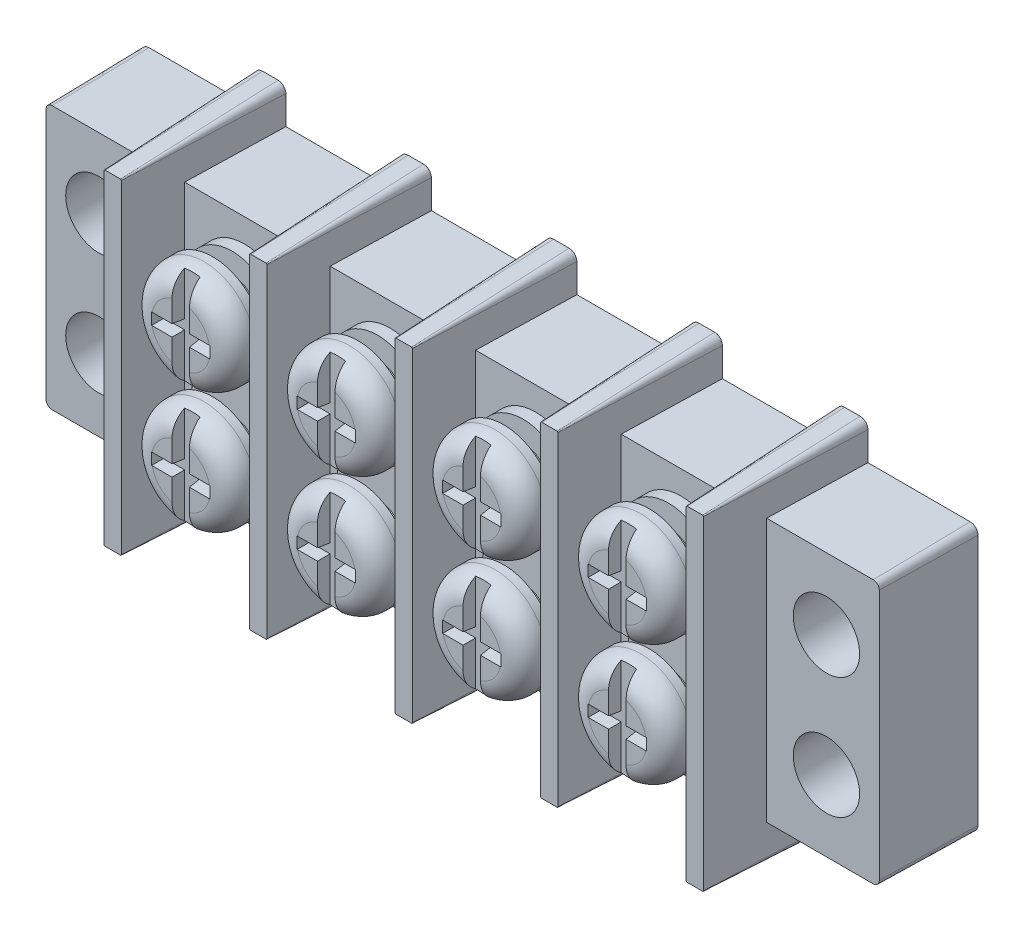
SolidWorks part; units mm, degrees
ref_plane "Plane1" through (0, 0, 0) normal (0, 0, 1) x (1, 0, 0)
ref_plane "Plane2" through (0, 0, 0) normal (0, 1, 0) x (1, 0, 0)
ref_plane "Plane3" through (0, 0, 0) normal (1, 0, 0) x (0, 0, -1)
sketch "BASE Sketch" plane through (0, 0, 0) normal (0, 0, 1) x (1, 0, 0)
  line L1 (-3.5719, 12.192) -> (-3.5719, -4.2545)
  line L4 (-3.5719, 3.9688) -> (51.1969, 3.9687) construction
  line L5 (23.8125, 3.9688) -> (23.8125, -4.7625) construction
  line L7 (-3.0639, 12.7) -> (50.6889, 12.7)
  line L8 (-3.0639, -4.7625) -> (50.6889, -4.7625)
  line L11 (51.1969, 12.192) -> (51.1969, -4.2545)
  circle A0 centre (0, 0) radius 1.7526 construction
  arc A1 (-3.0639, 12.7) -> (-3.5719, 12.192) centre (-3.0639, 12.192) ccw
  arc A2 (-3.0639, -4.7625) -> (-3.5719, -4.2545) centre (-3.0639, -4.2545) cw
  arc A3 (50.6889, -4.7625) -> (51.1969, -4.2545) centre (50.6889, -4.2545) ccw
  arc A4 (50.6889, 12.7) -> (51.1969, 12.192) centre (50.6889, 12.192) cw
  dimension "SCREW SIZE" = 3.5052
  dimension "GENERAL FILET" = 0.508
  dimension "M" = 47.625
  dimension "FIRST HOLE FROM END" = 3.5719
  dimension "LENGTH" = 54.7688
  dimension "BASE WIDTH" = 17.4625
  dimension "HOLE WIDTH" = 7.9375
extrude "BASE" add sketch "BASE Sketch" along normal blind 6.35 draft 1
sketch "RIB Sketch" plane through (0, 0, 0) normal (0, 0, -1) x (-1, 0, 0)
  line L0 (-4.3653, 15.0812) -> (-5.3813, 15.0812)
  line L1 (-3.8573, 14.5732) -> (-3.8573, -6.6358)
  line L2 (-5.3813, -7.1437) -> (-4.3653, -7.1437)
  line L3 (-5.8893, -6.6358) -> (-5.8893, 14.5732)
  line L4 (-4.8733, 15.0812) -> (-4.8733, -7.1438) construction
  line L5 (3.461, 3.9688) -> (-3.8573, 3.9687) construction
  line L6 (3.461, 12.192) -> (3.461, -4.2545) construction
  line L8 (3.461, 12.192) -> (3.461, -4.2545) construction
  arc A0 (-3.8573, 14.5732) -> (-4.3653, 15.0812) centre (-4.3653, 14.5732) ccw
  arc A1 (-5.8893, 14.5732) -> (-5.3813, 15.0812) centre (-5.3813, 14.5732) cw
  arc A2 (-5.8893, -6.6358) -> (-5.3813, -7.1437) centre (-5.3813, -6.6358) ccw
  arc A3 (-4.3653, -7.1437) -> (-3.8573, -6.6358) centre (-4.3653, -6.6358) ccw
  dimension "D1" = 2.032
  dimension "D2" = 8.3344
  dimension "RIB WIDTH" = 22.225
extrude "RIB" add sketch "RIB Sketch" against normal blind 10.3124 draft 2.5
sketch "HOLE Sketch" plane through (0, 0, 0) normal (0, 0, -1) x (-1, 0, 0)
  circle A0 centre (0, 0) radius 2.1717
  dimension "HOLE DIA" = 4.3434
extrude "HOLE" cut sketch "HOLE Sketch" against normal through all
pattern_linear "RIB Pattern" count 5 spacing 9.525 along (1, 0, 0) of "RIB"
pattern_linear "HOLE Pattern" count 6 spacing 9.525 along (1, 0, 0) count 2 spacing 7.9375 along (0, 1, 0) of "HOLE"
sketch "TERMINAL Sketch" plane through (0, 0, 6.35) normal (0, 0, 1) x (1, 0, 0)
  line L0 (-3.5719, 3.9688) -> (51.1969, 3.9687) construction
  line L4 (7.1559, 3.9688) -> (11.8941, 3.9688) construction
  line L5 (9.525, 11.0443) -> (9.525, -3.1068) construction
  circle A0 centre (9.525, 7.9375) radius 1.7475
  circle A1 centre (9.525, 0) radius 1.7475
  arc A2 (12.4243, 6.8211) -> (6.6257, 6.8211) centre (9.525, 7.9375) ccw
  arc A3 (12.4243, 1.1164) -> (6.6257, 1.1164) centre (9.525, 0) cw
  arc A4 (6.6257, 6.8211) -> (6.6257, 1.1164) centre (-0.7816, 3.9688) cw
  arc A5 (12.4243, 6.8211) -> (12.4243, 1.1164) centre (19.8316, 3.9688) ccw
  dimension "D5" = 3.495
  dimension "D2" = 3.1068
  dimension "D6" = 7.9375
extrude "TERMINAL" add sketch "TERMINAL Sketch" along normal blind 0.8128
pattern_linear "TERMINAL Pattern" count 4 spacing 9.525 along (1, 0, 0) of "TERMINAL"
sketch "SCREW Sketch" plane through (0, 0, 0) normal (0, 1, 0) x (1, 0, 0)
  line L0 (11.2776, -8.4328) -> (11.2776, -6.35)
  line L1 (11.2776, -8.4328) -> (12.954, -8.4328)
  line L2 (5.6121, -6.35) -> (13.6596, -6.35) construction
  line L3 (11.2776, -6.35) -> (9.525, -6.35)
  line L4 (9.525, -6.35) -> (9.525, -10.5156)
  line L5 (12.954, -10.5156) -> (9.525, -10.5156)
  line L6 (9.525, -6.35) -> (9.525, -6.8704) construction
  line L8 (12.954, -10.5156) -> (12.954, -8.4328)
  line L9 (7.7775, -7.1628) -> (11.2725, -7.1628) construction
  dimension "D1" = 1.27
  dimension "SCREW HEAD THICK" = 2.0828
  dimension "D3" = 9.525
  dimension "SCREW HEAD DIA" = 6.858
  dimension "SCREW DIA" = 3.5052
revolve "SCREW" add sketch "SCREW Sketch" angle 360 about L6
fillet "SCREW HEAD FILET" radius 1.5204 1 edges at (6.096, 0, 10.5156)
sketch "SCREW SLOT Sketch" plane through (0, 0, 10.5156) normal (0, 0, 1) x (1, 0, 0)
  line L0 (8.9535, 3.429) -> (10.0965, 3.429)
  line L1 (8.9535, 3.429) -> (8.9535, 0.381)
  line L2 (10.0965, -3.429) -> (8.9535, -3.429)
  line L3 (10.0965, -3.429) -> (10.0965, -0.381)
  line L4 (7.6164, 0.381) -> (8.9535, 0.381)
  line L5 (7.6164, 0.381) -> (7.6164, -0.381)
  line L6 (11.4336, -0.381) -> (10.0965, -0.381)
  line L7 (11.4336, -0.381) -> (11.4336, 0.381)
  line L8 (9.525, 3.429) -> (9.525, -3.429) construction
  line L9 (7.6164, 0) -> (11.4336, 0) construction
  line L10 (10.0965, 0.381) -> (10.0965, 3.429)
  line L11 (8.9535, -0.381) -> (8.9535, -3.429)
  line L12 (8.9535, -0.381) -> (7.6164, -0.381)
  line L13 (10.0965, 0.381) -> (11.4336, 0.381)
  circle A0 centre (9.525, 0) radius 3.429 construction
  circle A1 centre (9.525, 0) radius 3.429 construction
  circle A2 centre (9.525, 0) radius 1.9086 construction
  dimension "SCREW SLOT WIDTH" = 1.143
  dimension "D2" = 0.762
extrude "SCREW SLOT" cut sketch "SCREW SLOT Sketch" against normal blind 0.7602 draft 5
pattern_linear "SCREW PATTERN" count 4 spacing 9.525 along (1, 0, 0) count 2 spacing 7.9375 along (0, 1, 0) of "SCREW SLOT", "SCREW", "SCREW HEAD FILET"
equation "\"SPACING\"=3/8"
equation "\"BARRIER GAP\"=.295"
equation "\"NO OF TERMINALS\"=INT(\"M@BASE Sketch\"/\"SPACING\"-1)"
equation "\"D2@RIB Sketch\" = \"FIRST HOLE FROM END@BASE Sketch\"+\"SPACING\"/2"
equation "\"D1@RIB Sketch\" = \"SPACING\"-\"BARRIER GAP\""
equation "\"D3@RIB Pattern\" = \"SPACING\""
equation "\"D1@RIB Pattern\" = \"NO OF TERMINALS\"+1"
equation "\"D3@HOLE Pattern\" = \"SPACING\""
equation "\"D4@HOLE Pattern\" = \"HOLE WIDTH@BASE Sketch\""
equation "\"D1@HOLE Pattern\" = \"NO OF TERMINALS\"+2"
equation "\"D2@TERMINAL Sketch\" = \"BARRIER GAP\"*.41463"
equation "\"D5@TERMINAL Sketch\" = \"SCREW SIZE@BASE Sketch\"-.0004"
equation "\"D6@TERMINAL Sketch\" = \"HOLE WIDTH@BASE Sketch\""
equation "\"D3@TERMINAL Pattern\" = \"SPACING\""
equation "\"D1@TERMINAL Pattern\" = \"NO OF TERMINALS\""
equation "\"D3@SCREW Sketch\" = \"SPACING\""
equation "\"SCREW HEAD FILLET@SCREW HEAD FILET\" = \"SCREW HEAD THICK@SCREW Sketch\"*.73"
equation "\"SCREW SLOT WIDTH@SCREW SLOT Sketch\" = \"SCREW HEAD DIA@SCREW Sketch\"*.16666"
equation "\"D2@SCREW SLOT Sketch\" = \"SCREW SLOT WIDTH@SCREW SLOT Sketch\"*.66666"
equation "\"D1@SCREW SLOT\" = \"SCREW HEAD FILLET@SCREW HEAD FILET\"/2"
equation "\"D4@SCREW PATTERN\" = \"HOLE WIDTH@BASE Sketch\""
equation "\"D3@SCREW PATTERN\" = \"SPACING\""
equation "\"D1@SCREW PATTERN\" = \"NO OF TERMINALS\""
equation "\"SCREW DIA@SCREW Sketch\" = \"SCREW SIZE@BASE Sketch\""
